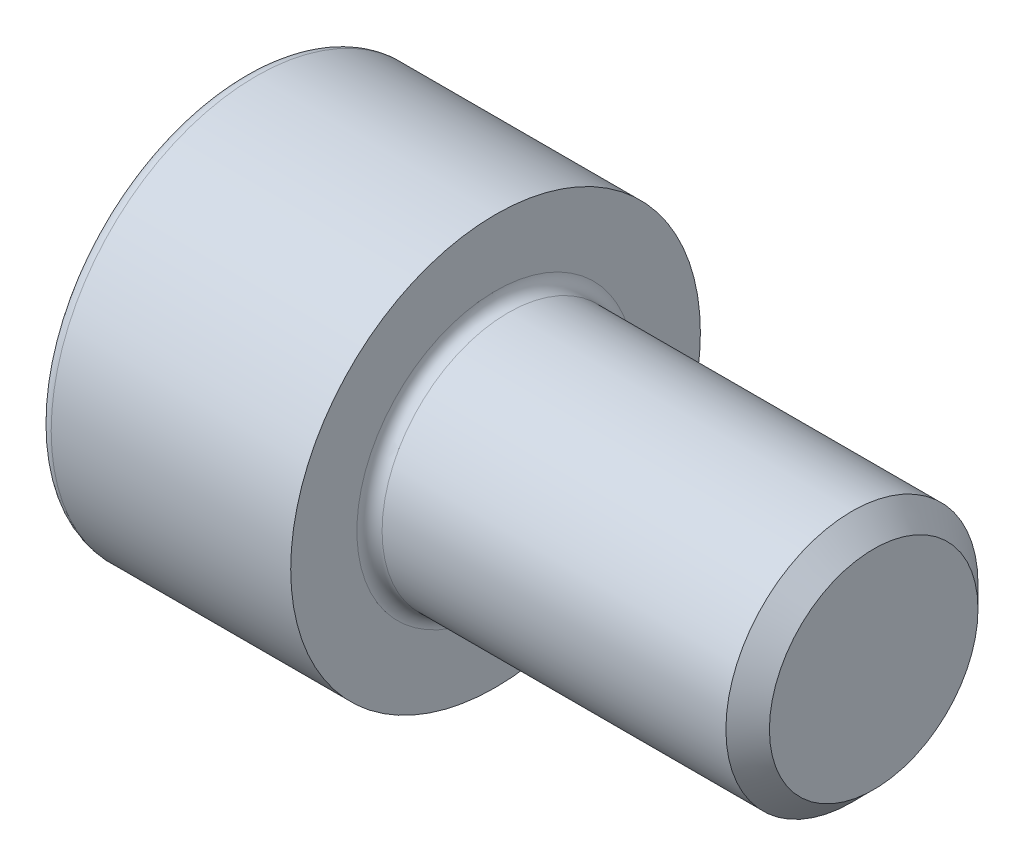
SolidWorks part; units mm, degrees
ref_plane "Plane1" through (0, 0, 0) normal (0, 0, 1) x (1, 0, 0)
ref_plane "Plane2" through (0, 0, 0) normal (0, 1, 0) x (1, 0, 0)
ref_plane "Plane3" through (0, 0, 0) normal (1, 0, 0) x (0, 0, -1)
sketch "BodySke" plane through (0, 0, 0) normal (0, 0, 1) x (1, 0, 0)
  line L0 (0, 0) -> (0, 6.5)
  line L1 (0, 6.5) -> (8, 6.5)
  line L2 (8, 6.5) -> (8, 4)
  line L3 (8, 4) -> (19.3095, 4)
  line L4 (20, 3.3095) -> (20, 0)
  line L5 (20, 0) -> (0, 0)
  line L6 (-31.75, 0) -> (127, 0) construction
  line L8 (20, 3.3095) -> (19.3095, 4)
  line L10 (20, -3.3095) -> (19.3095, -4) construction
  line L11 (9.25, 9.525) -> (9.25, 3.175) construction
  line L12 (8, 9.525) -> (8, 3.175) construction
  line L13 (-40, 9.525) -> (-40, 3.175) construction
  dimension "Diameter" = 8
  dimension "Head_ht" = 8
  dimension "Length" = 12
  dimension "Body_ch_ang" = 45
  dimension "Head_dia" = 13
  dimension "Minor_dia" = 6.619
  dimension "Advance" = 1.25
  dimension "Thread_nom" = 12
  dimension "Thread_length" = 60
revolve "Base-Revolve" add sketch "BodySke"
fillet "Fillet1" radius 0.4 1 edges at (8, 0, 4)
fillet "Fillet2" radius 0.4 1 edges at (0, 0, 6.5)
sketch "Sketch2" plane through (0, 0, 0) normal (0, 0, 1) x (1, 0, 0)
  line L0 (0, 3.0475) -> (4, 3.0475)
  line L1 (4, 3.0475) -> (5.7595, 0)
  line L2 (-31.75, 0) -> (127, 0) construction
  line L3 (5.7595, 0) -> (0, 0)
  line L4 (0, 0) -> (0, 3.0475)
  line L6 (0, 0) -> (47.625, 0) construction
  dimension "D1" = 3.0475
  dimension "D2" = 60
  dimension "Depth" = 4
revolve "Hex-PreBroach" cut sketch "Sketch2" angle 360 about L6
sketch "Sketch3" plane through (0, 0, 0) normal (-1, 0, 0) x (0, 0.5, 0.866)
  line L0 (1.7595, 3.0475) -> (-1.7595, 3.0475)
  line L1 (-1.7595, 3.0475) -> (-3.5189, 0)
  line L2 (1.7595, 3.0475) -> (3.5189, 0)
  line L3 (1.7595, -3.0475) -> (3.5189, 0)
  line L4 (1.7595, -3.0475) -> (-1.7595, -3.0475)
  line L5 (-1.7595, -3.0475) -> (-3.5189, 0)
  dimension "D1" = 3.0475
  dimension "D2" = 3.0475
  dimension "Hex_size" = 6.095
extrude "Hex" cut sketch "Sketch3" against normal blind 4
sketch "ThdSchSke" plane through (0, 0, 0) normal (0, 0, 1) x (1, 0, 0)
  line L0 (11.75, -3.3095) -> (11.2665, -4)
  line L1 (11.75, -3.3095) -> (12.2335, -4)
  line L2 (12.2335, -4) -> (12.2335, -5)
  line L3 (-3.175, 0) -> (5.1513, 0) construction
  line L4 (0, 6.1) -> (0, -6.1) construction
  line L5 (12.2335, -5) -> (11.2665, -5)
  line L6 (11.2665, -5) -> (11.2665, -4)
  dimension "Thread_minor" = 6.619
  dimension "Diameter" = 8
  dimension "Start" = 11.75
  dimension "SideAngle" = 55
  dimension "VeeAngle" = 70
  dimension "Overcut" = 10
revolve "ThreadSchematic" [suppressed] cut sketch "ThdSchSke" angle 360 about L3
pattern_linear "ThdSchPat" [suppressed]
equation "\"D2@Sketch3\" = \"Hex_size@Sketch3\" / 2"
equation "\"D1@Sketch3\" = \"Hex_size@Sketch3\" / 2"
equation "\"D1@Sketch2\" = \"Hex_size@Sketch3\" / 2"
equation "\"Thread_minor@ThreadCosmetic\"  =  \"Minor_dia@BodySke\""
equation "\"Depth@Sketch2\" =  \"Key_eng@Hex\""
equation "\"Thread_length@ThreadCosmetic\" = ((sgn( (\"Length@BodySke\" - \"Advance@BodySke\" * 3.0) - \"Thread_nom@BodySke\" )-1)*( (\"Length@BodySke\" - \"Advance@BodySke\" * 3.0) - \"Thread_nom@BodySke\" ))/-2+ \"Thread_no"
equation "\"Thread_minor@ThdSchSke\" = \"Minor_dia@BodySke\""
equation "\"Diameter@ThdSchSke\" = \"Diameter@BodySke\""
equation "\"Overcut@ThdSchSke\" = \"Diameter@BodySke\" * 1.25"
equation "\"Start@ThdSchSke\" = \"Head_ht@BodySke\" + \"Length@BodySke\" - \"Thread_length@ThreadCosmetic\"  '---Non-countersunk---"
equation "\"Num_threads@ThdSchPat\" = int( \"Thread_length@ThreadCosmetic\" / \"Advance@BodySke\" + 0.999 )  + 1"
equation "\"Advance@ThdSchPat\" = \"Thread_length@ThreadCosmetic\" /  (\"Num_threads@ThdSchPat\" - 1) 'relax it"
equation "\"Num_threads@ThdSchPat\" = \"Num_threads@ThdSchPat\" - sgn( \"Num_threads@ThdSchPat\" - 1) '---chamfered tips only---"
